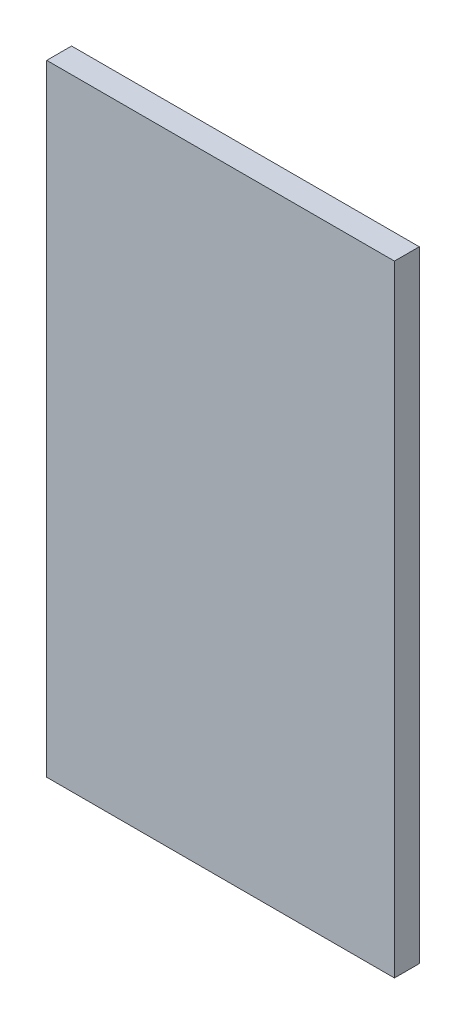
SolidWorks part; units mm, degrees
ref_plane "Front Plane" through (0, 0, 0) normal (0, 0, 1) x (1, 0, 0)
ref_plane "Top Plane" through (0, 0, 0) normal (0, 1, 0) x (1, 0, 0)
ref_plane "Right Plane" through (0, 0, 0) normal (1, 0, 0) x (0, 0, -1)
sketch "Sketch1" plane through (0, 0, 0) normal (1, 0, 0) x (0, 0, -1)
  line L1 (-1.5, -37.5) -> (1.5, -37.5)
  line L2 (-1.5, -37.5) -> (-1.5, 37.5)
  line L3 (-1.5, 37.5) -> (1.5, 37.5)
  line L4 (1.5, -37.5) -> (1.5, 37.5)
  line L5 (-1.5, -37.5) -> (1.5, 37.5) construction
  line L6 (-1.5, 37.5) -> (1.5, -37.5) construction
  point P0 (0, 0)
  dimension "D1" = 3
  dimension "D2" = 75
extrude "Boss-Extrude1" add sketch "Sketch1" along normal mid plane 42
